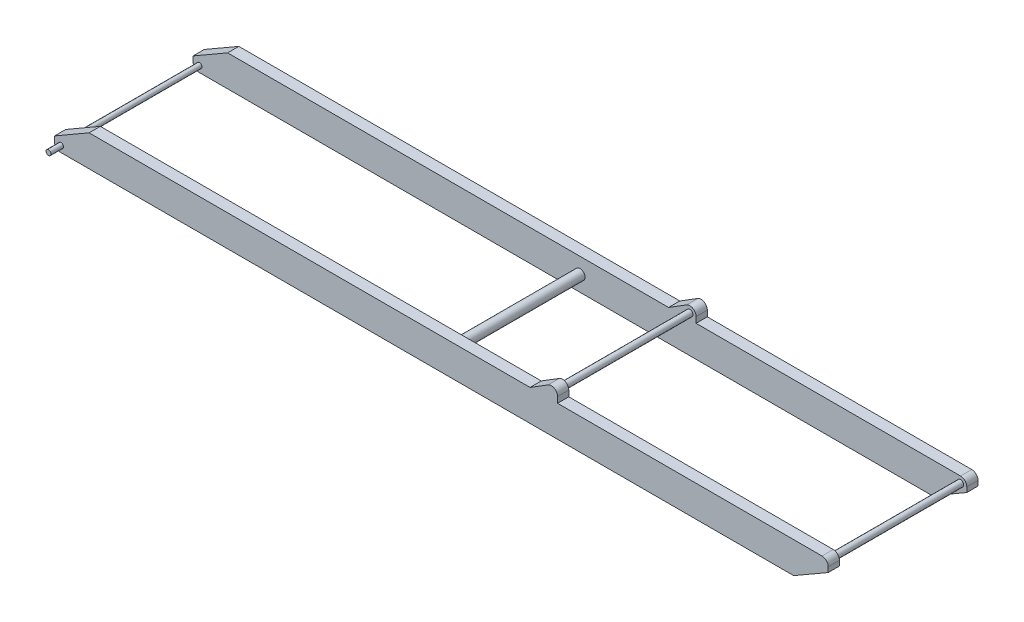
SolidWorks part; units mm, degrees
ref_plane "Face" through (0, 0, 0) normal (0, 0, 1) x (1, 0, 0)
ref_plane "Dessus" through (0, 0, 0) normal (0, 1, 0) x (1, 0, 0)
ref_plane "Droite" through (0, 0, 0) normal (1, 0, 0) x (0, 0, -1)
sketch "Esquisse1" plane through (0, 0, 0) normal (0, 0, 1) x (1, 0, 0)
  line L0 (50, 0) -> (50, -40)
  line L1 (0, 50) -> (-5872.8719, 50)
  line L2 (50, -40) -> (-227.1281, -200)
  line L3 (-227.1281, -200) -> (-6100, -200)
  line L4 (-6150, -110) -> (-6150, -150)
  line L5 (-6150, -110) -> (-5872.8719, 50)
  circle A0 centre (0, 0) radius 25
  arc A1 (-6100, -200) -> (-6150, -150) centre (-6100, -150) cw
  circle A2 centre (-6098.1555, -150) radius 20
  arc A3 (50, 0) -> (0, 50) centre (0, 0) ccw
  dimension "D1" = 50
  dimension "D2" = 250
  dimension "D4" = 40
  dimension "D8" = 50
  dimension "D3" = 6150
  dimension "D5" = 6100
  dimension "D6" = 200
  dimension "D7" = 50
  dimension "D9" = 30
  dimension "D10" = 40
  dimension "D11" = 30
  dimension "D12" = 40
extrude "Extrusion1" add sketch "Esquisse1" along normal mid plane 1200
sketch "Esquisse2" plane through (0, 50, 0) normal (0, 1, 0) x (1, 0, 0)
  line L0 (0, 600) -> (-5872.8719, 600) construction
  line L1 (-6402.7566, 510) -> (211.9968, 510)
  line L2 (-6402.7566, 510) -> (-6402.7566, -510)
  line L3 (-6402.7566, -510) -> (211.9968, -510)
  line L4 (211.9968, 510) -> (211.9968, -510)
  dimension "D1" = 1020
  dimension "D2" = 90
extrude "Enlèv. mat.-Extru.1" cut sketch "Esquisse2" against normal through all
sketch "Esquisse3" plane through (0, 0, 0) normal (0, 0, 1) x (1, 0, 0)
  circle A0 centre (-6098.1555, -150) radius 20
  circle A1 centre (-6098.1555, -150) radius 20 construction
extrude "Extrusion2" add sketch "Esquisse3" along normal mid plane 1400
sketch "Esquisse4" plane through (0, 0, 0) normal (0, 0, 1) x (1, 0, 0)
  circle A0 centre (0, 0) radius 25 construction
  circle A1 centre (0, 0) radius 25
extrude "Extrusion3" add sketch "Esquisse4" along normal mid plane 1200
sketch "Esquisse5" plane through (0, 0, 0) normal (0, 0, 1) x (1, 0, 0)
  line L0 (0, 50) -> (-5872.8719, 50) construction
  circle A0 centre (-3049.0777, -75) radius 40
  dimension "D1" = 80
  dimension "D2" = 3050
  dimension "D3" = 125
extrude "Extrusion4" add sketch "Esquisse5" along normal mid plane 1200
sketch "Esquisse6" plane through (0, 0, 0) normal (0, 0, 1) x (1, 0, 0)
  line L0 (0, 50) -> (-5872.8719, 50) construction
  circle A0 centre (-2169.0822, 97) radius 25
  dimension "D3" = 50
  dimension "D1" = 2171.25
  dimension "D2" = 47
extrude "Extrusion5" add sketch "Esquisse6" along normal mid plane 1200
sketch "Esquisse7" plane through (0, 0, 600) normal (0, 0, 1) x (1, 0, 0)
  line L0 (-2119.0822, 97) -> (-2119.0822, 47)
  line L1 (-2119.0822, 47) -> (-2344.1846, 47)
  line L2 (-2344.1846, 47) -> (-2195.4842, 139.461)
  arc A0 (-2119.0822, 97) -> (-2195.4842, 139.461) centre (-2169.0822, 97) ccw
  circle A1 centre (-2169.0822, 97) radius 25 construction
  dimension "D1" = 100
extrude "Extrusion6" add sketch "Esquisse7" against normal up to surface (90 mm away)
sketch "Esquisse8" plane through (0, 0, -600) normal (0, 0, -1) x (-1, 0, 0)
  line L9 (2119.0822, 97) -> (2119.0822, 50)
  line L10 (2119.0822, 50) -> (0, 50)
  line L11 (-50, 0) -> (-50, -40)
  line L12 (-50, -40) -> (227.1281, -200)
  line L13 (227.1281, -200) -> (6100, -200)
  line L14 (6150, -150) -> (6150, -110)
  line L15 (6150, -110) -> (5872.8719, 50)
  line L16 (5872.8719, 50) -> (2339.3599, 50)
  line L17 (2339.3599, 50) -> (2195.4842, 139.461)
  line L18 (2119.0822, 97) -> (2119.0822, 50)
  line L19 (2119.0822, 50) -> (0, 50)
  line L20 (-50, 0) -> (-50, -40)
  line L21 (-50, -40) -> (227.1281, -200)
  line L22 (227.1281, -200) -> (6100, -200)
  line L23 (6150, -150) -> (6150, -110)
  line L24 (6150, -110) -> (5872.8719, 50)
  line L25 (5872.8719, 50) -> (2339.3599, 50)
  line L26 (2339.3599, 50) -> (2195.4842, 139.461)
  arc A3 (0, 50) -> (-50, 0) centre (0, 0) ccw
  arc A4 (6100, -200) -> (6150, -150) centre (6100, -150) ccw
  arc A5 (2195.4842, 139.461) -> (2119.0822, 97) centre (2169.0822, 97) ccw
  arc A6 (0, 50) -> (-50, 0) centre (0, 0) ccw
  arc A7 (6100, -200) -> (6150, -150) centre (6100, -150) ccw
  arc A8 (2195.4842, 139.461) -> (2119.0822, 97) centre (2169.0822, 97) ccw
  dimension "D1" = 0
extrude "Extrusion7" add sketch "Esquisse8" against normal up to surface (90 mm away)
